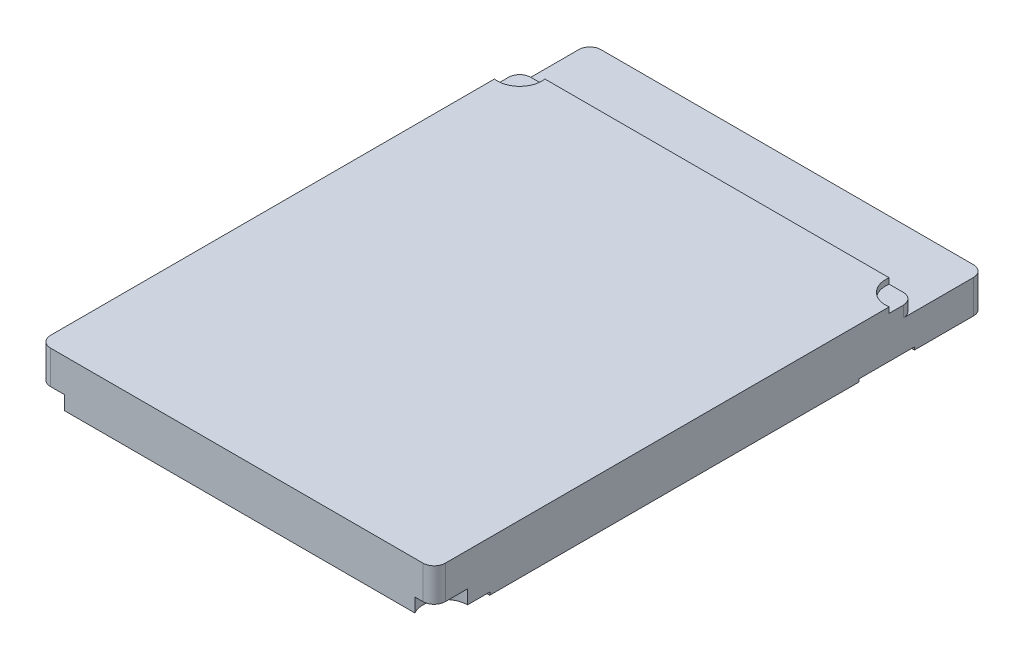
SolidWorks part; units mm, degrees
ref_plane "Front Plane" through (0, 0, 0) normal (0, 0, 1) x (1, 0, 0)
ref_plane "Top Plane" through (0, 0, 0) normal (0, 1, 0) x (1, 0, 0)
ref_plane "Right Plane" through (0, 0, 0) normal (1, 0, 0) x (0, 0, -1)
sketch "Skizze1" plane through (0, 0, 0) normal (0, 0, 1) x (1, 0, 0)
  line L1 (19.21, -7.6077) -> (90.21, -7.6077)
  line L2 (19.21, -7.6077) -> (19.21, -16.6077)
  line L3 (19.21, -16.6077) -> (90.21, -16.6077)
  line L4 (90.21, -7.6077) -> (90.21, -16.6077)
  dimension "D1" = 9
  dimension "D2" = 71
extrude "Linear austragen1" add sketch "Skizze1" along normal blind 99
sketch "Skizze2" plane through (0, -7.6077, 0) normal (0, 1, 0) x (1, 0, 0)
  line L0 (90.21, -99) -> (90.21, 0) construction
  line L1 (90.21, -12.6188) -> (19.21, -12.6188)
  line L2 (90.21, -12.6188) -> (90.21, 0)
  line L3 (90.21, 0) -> (19.21, 0)
  line L4 (19.21, -12.6188) -> (19.21, 0)
extrude "Schnitt-Linear austragen1" cut sketch "Skizze2" against normal blind 3
fillet "Verrundung1" radius 2 4 edges at (90.21, -13.6077, 0) (19.21, -13.6077, 0) (90.21, -9.1077, 12.6188) (19.21, -9.1077, 12.6188)
fillet "Verrundung2" radius 2 2 edges at (90.21, -12.1077, 99) (19.21, -12.1077, 99)
sketch "Skizze3" plane through (0, -16.6077, 0) normal (0, -1, 0) x (1, 0, 0)
  circle A0 centre (19.7958, 98.4142) radius 4
  arc A1 (21.21, 99) -> (19.21, 97) centre (21.21, 97) ccw construction
  circle A2 centre (90.21, 97) radius 4
  arc A3 (90.21, 97) -> (88.21, 99) centre (88.21, 97) ccw construction
  dimension "D1" = 8
  dimension "D2" = 8
extrude "Schnitt-Linear austragen2" cut sketch "Skizze3" against normal blind 3
sketch "Skizze4" plane through (0, -7.6077, 0) normal (0, 1, 0) x (1, 0, 0)
  circle A0 centre (19.7958, -13.2046) radius 4
  arc A1 (21.21, -12.6188) -> (19.21, -14.6188) centre (21.21, -14.6188) ccw construction
  circle A2 centre (89.6242, -13.2046) radius 4
  arc A3 (90.21, -14.6188) -> (88.21, -12.6188) centre (88.21, -14.6188) ccw construction
  dimension "D1" = 8
  dimension "D2" = 8
extrude "Schnitt-Linear austragen3" cut sketch "Skizze4" against normal blind 1
sketch "Skizze6" plane through (19.21, 0, 0) normal (-1, 0, 0) x (0, 0, 1)
  line L0 (94.4573, -16.6077) -> (2, -16.6077) construction
  line L1 (12.6188, -17.6646) -> (22.6188, -17.6646)
  line L2 (12.6188, -17.6646) -> (12.6188, -16.1077)
  line L3 (12.6188, -16.1077) -> (22.6188, -16.1077)
  line L4 (22.6188, -17.6646) -> (22.6188, -16.1077)
  dimension "D1" = 0.5
  dimension "D2" = 10
extrude "Schnitt-Linear austragen4" cut sketch "Skizze6" against normal through all
sketch "Skizze7" plane through (19.21, 0, 0) normal (-1, 0, 0) x (0, 0, 1)
  line L0 (99, -16.6077) -> (99, -13.6077) construction
  line L1 (99, -16.1077) -> (89, -16.1077)
  line L2 (99, -16.1077) -> (99, -18.2966)
  line L3 (99, -18.2966) -> (89, -18.2966)
  line L4 (89, -16.1077) -> (89, -18.2966)
  line L5 (94.4142, -16.6077) -> (99, -16.6077) construction
  dimension "D1" = 10
  dimension "D2" = 0.5
extrude "Schnitt-Linear austragen5" cut sketch "Skizze7" against normal through all
